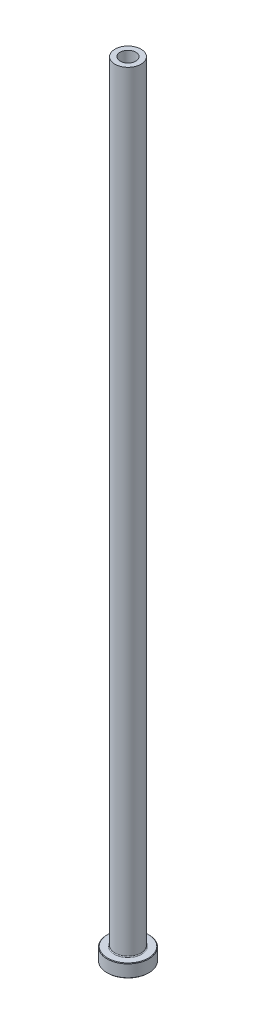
SolidWorks part; units mm, degrees
ref_plane "Front Plane" through (0, 0, 0) normal (0, 0, 1) x (1, 0, 0)
ref_plane "Top Plane" through (0, 0, 0) normal (0, 1, 0) x (1, 0, 0)
ref_plane "Right Plane" through (0, 0, 0) normal (1, 0, 0) x (0, 0, -1)
sketch "Sketch1" plane through (0, 0, 0) normal (0, 0, 1) x (1, 0, 0)
  line L0 (-3, 300) -> (-5, 300)
  line L1 (-5, 300) -> (-5, 5)
  line L2 (-5, 5) -> (-8, 5)
  line L3 (-8, 5) -> (-8, 0)
  line L4 (8.8, 0) -> (-8.8, 0) construction
  line L5 (-8, 0) -> (-3.25, 0)
  line L6 (-3, 255) -> (-3, 300)
  line L7 (0, 92.1877) -> (0, -15.5353) construction
  line L8 (0, -8.8) -> (0, 8.8) construction
  line L9 (-3, 255) -> (-3.25, 243)
  line L10 (-3.25, 243) -> (-3.25, 0)
  dimension "D1" = 0.25
  dimension "ID" = 6
  dimension "OD" = 10
  dimension "L" = 300
  dimension "H" = 16
  dimension "T" = 5
  dimension "N" = 45
  dimension "D2" = 12
revolve "Revolve1" add sketch "Sketch1" angle 360 about L7
fillet "Fillet1" radius 0.3 1 edges at (0, 5, 5)
chamfer "Chamfer1" distance 0.2 angle 45 2 edges at (0, 5, 8) (0, 0, 8)
chamfer "Chamfer3" distance 0.5 angle 45 1 edges at (0, 0, 3.25)
